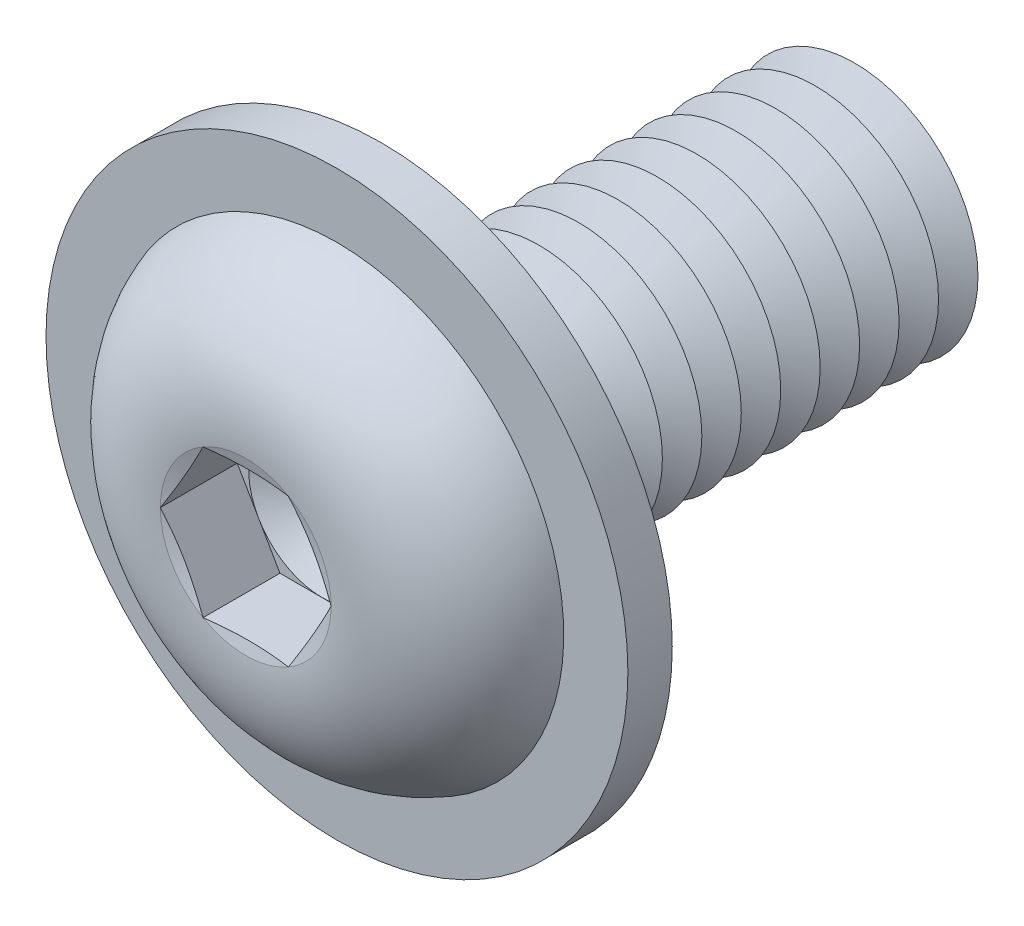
SolidWorks part; units mm, degrees
ref_plane "Front Plane" through (0, 0, 0) normal (0, 0, 1) x (1, 0, 0)
ref_plane "Top Plane" through (0, 0, 0) normal (0, 1, 0) x (1, 0, 0)
ref_plane "Right Plane" through (0, 0, 0) normal (1, 0, 0) x (0, 0, -1)
sketch "Sketch1" plane through (0, 0, 0) normal (1, 0, 0) x (0, 0, -1)
  line L0 (0, 2.5) -> (0, 4.75)
  line L3 (0, 2.5) -> (10, 2.5)
  line L4 (10, 2.5) -> (10, 0)
  line L5 (10, 0) -> (-2.75, 0) construction
  line L6 (-2.75, 0) -> (10, 0)
  line L7 (-2.75, 1.732) -> (-2.75, 0.866) construction
  line L8 (-2.75, 0.866) -> (-2.75, 0)
  line L9 (-2.75, 1.732) -> (-2.5179, 0.866)
  line L10 (-2.5179, 0.866) -> (-2.75, 0.866)
  line L11 (10, 0) -> (22.7481, 0) construction
  line L12 (0, 4.75) -> (-2.75, 4.75) construction
  arc A1 (0, 4.75) -> (-2.75, 1.732) centre (0, 1.9881) ccw
  point P8 (10, 1.25)
  dimension "D1" = 9.5
  dimension "D2" = 5
  dimension "D3" = 2.75
  dimension "D4" = 3.4641
  dimension "D5" = 10
  dimension "D6" = 15
revolve "Revolve1" add sketch "Sketch1" angle 360 about L5
fillet "Fillet1" radius 0.4 1 edges at (-2.5, 0, 0)
sketch "Sketch2" plane through (0, 0, 0) normal (1, 0, 0) x (0, 0, -1)
  line L0 (9.6, 2.5) -> (10.4, 2.5)
  line L1 (10, 2.5) -> (0.4, 2.5) construction
  line L2 (10.4, 2.5) -> (10, 1.8072)
  line L3 (10, -2.5) -> (10, 2.5) construction
  line L4 (10, 1.8072) -> (9.6, 2.5)
  dimension "D1" = 0.8
revolve "Cut-Revolve1" cut sketch "Sketch2" angle 360 about axis through (0, 0, -10) along (0, 0, -1)
pattern_linear "LPattern1" count 12 spacing 0.8 along (0, 0, 1) of "Cut-Revolve1"
sketch "Sketch3" plane through (0, 0, 2.75) normal (0, 0, 1) x (1, 0, 0)
  line L7 (0.866, 1.5) -> (-0.866, 1.5)
  line L8 (-0.866, 1.5) -> (-1.7321, 0)
  line L9 (-1.7321, 0) -> (-0.866, -1.5)
  line L10 (-0.866, -1.5) -> (0.866, -1.5)
  line L11 (0.866, -1.5) -> (1.732, 0)
  line L12 (1.732, 0) -> (0.866, 1.5)
  circle A0 centre (0, 0) radius 1.5 construction
  circle A3 centre (0, 0) radius 1.7321 construction
extrude "Cut-Extrude1" cut sketch "Sketch3" against normal blind 1.56
sketch "Sketch4" plane through (0, 0, 1.19) normal (0, 0, 1) x (1, 0, 0)
  line L1 (0.866, 1.5) -> (-0.866, 1.5) construction
  circle A0 centre (0, 0) radius 1.5
extrude "Cut-Extrude2" cut sketch "Sketch4" against normal through all draft 60
sketch "Sketch5" plane through (0, 0, 0) normal (0, 0, -1) x (-1, 0, 0)
  circle A0 centre (0, 0) radius 5.9
  circle A1 centre (0, 0) radius 2.9
  circle A2 centre (0, 0) radius 2.9 construction
  dimension "D1" = 11.8
extrude "Boss-Extrude1" add sketch "Sketch5" against normal blind 0.9
